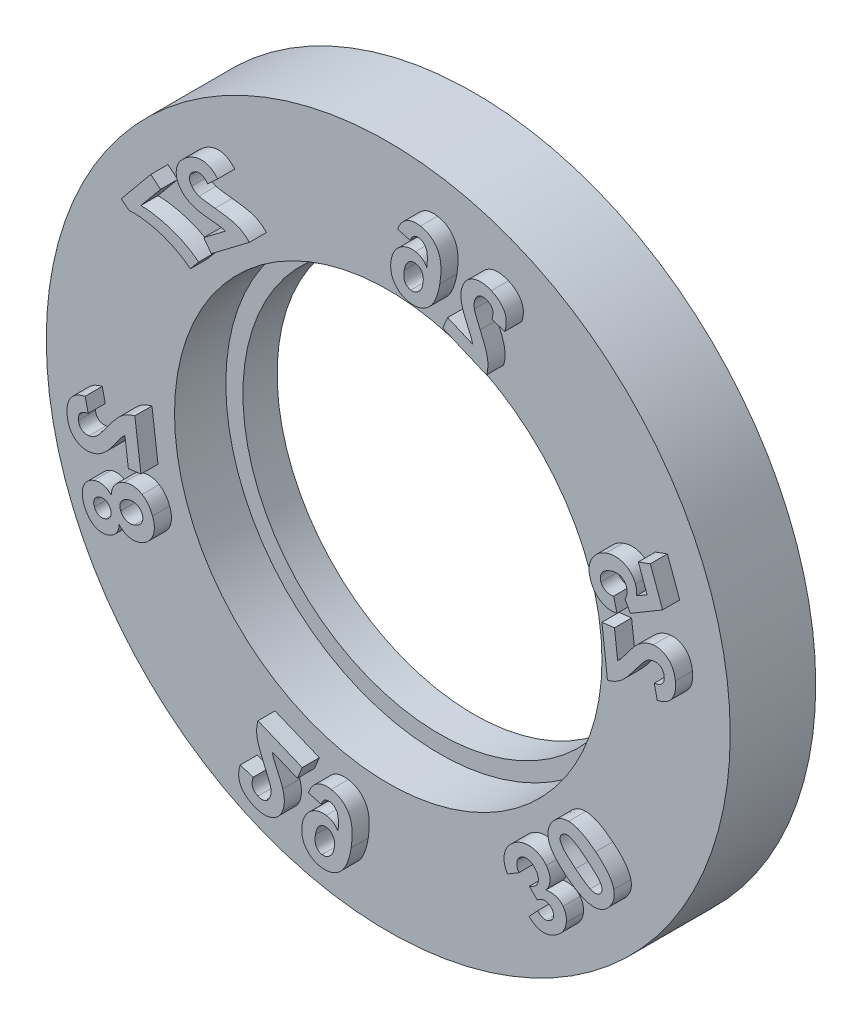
SolidWorks part; units mm, degrees
ref_plane "Front Plane" through (0, 0, 0) normal (0, 0, 1) x (1, 0, 0)
ref_plane "Top Plane" through (0, 0, 0) normal (0, 1, 0) x (1, 0, 0)
ref_plane "Right Plane" through (0, 0, 0) normal (1, 0, 0) x (0, 0, -1)
imported_body "Imported1"
other "DeleteFace2"
sketch "Sketch2" plane through (0, 0, 0) normal (0, 0, 1) x (1, 0, 0)
  line L2 (0, 0) -> (0, 21.375) construction
  line L3 (0, 0) -> (18.5113, 10.6875) construction
  line L4 (0, 0) -> (18.5113, -10.6875) construction
  line L5 (0, 0) -> (0, -21.375) construction
  line L6 (0, 0) -> (-18.5113, -10.6875) construction
  line L7 (0, 0) -> (-18.5113, 10.6875) construction
  circle A0 centre (0, 0) radius 13.8372 construction
  text T0 "25     26     27     28     29     30" font "Arial" height 4.2
  point P11 (0, 0)
  dimension "D1" = 6
extrude "Boss-Extrude1" add sketch "Sketch2" along normal blind 1
